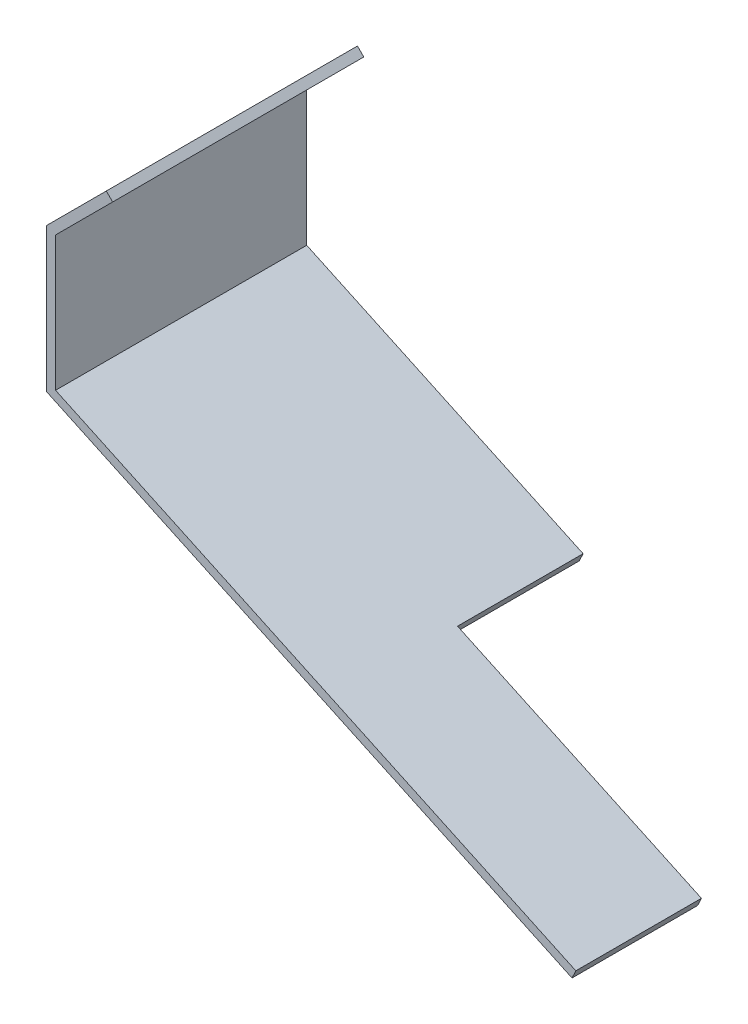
SolidWorks part; units mm, degrees
ref_plane "Plan de face" through (0, 0, 0) normal (0, 0, 1) x (1, 0, 0)
ref_plane "Plan de dessus" through (0, 0, 0) normal (0, 1, 0) x (1, 0, 0)
ref_plane "Plan de droite" through (0, 0, 0) normal (1, 0, 0) x (0, 0, -1)
sketch "Esquisse1" plane through (0, 0, 0) normal (0, 0, 1) x (1, 0, 0)
  line L0 (0, 0) -> (0, 75)
  line L1 (0, 75) -> (31.8198, 106.8198)
  line L2 (0, 0) -> (290.0185, -135.2378)
  dimension "D1" = 75
  dimension "D2" = 45
  dimension "D3" = 45
  dimension "D4" = 320
  dimension "D5" = 115
extrude "Extru.-Mince1" add sketch "Esquisse1" along normal mid plane 140 thin
sketch "Esquisse2" plane through (-2.1131, -4.5315, 0) normal (-0.4226, -0.9063, 0) x (0.9063, -0.4226, 0)
  line L1 (320, -70) -> (170, -70)
  line L2 (320, -70) -> (320, 0)
  line L3 (320, 0) -> (170, 0)
  line L4 (170, -70) -> (170, 0)
  dimension "D1" = 150
  dimension "D2" = 70
extrude "Enlèv. mat.-Extru.1" cut sketch "Esquisse2" against normal blind 10
